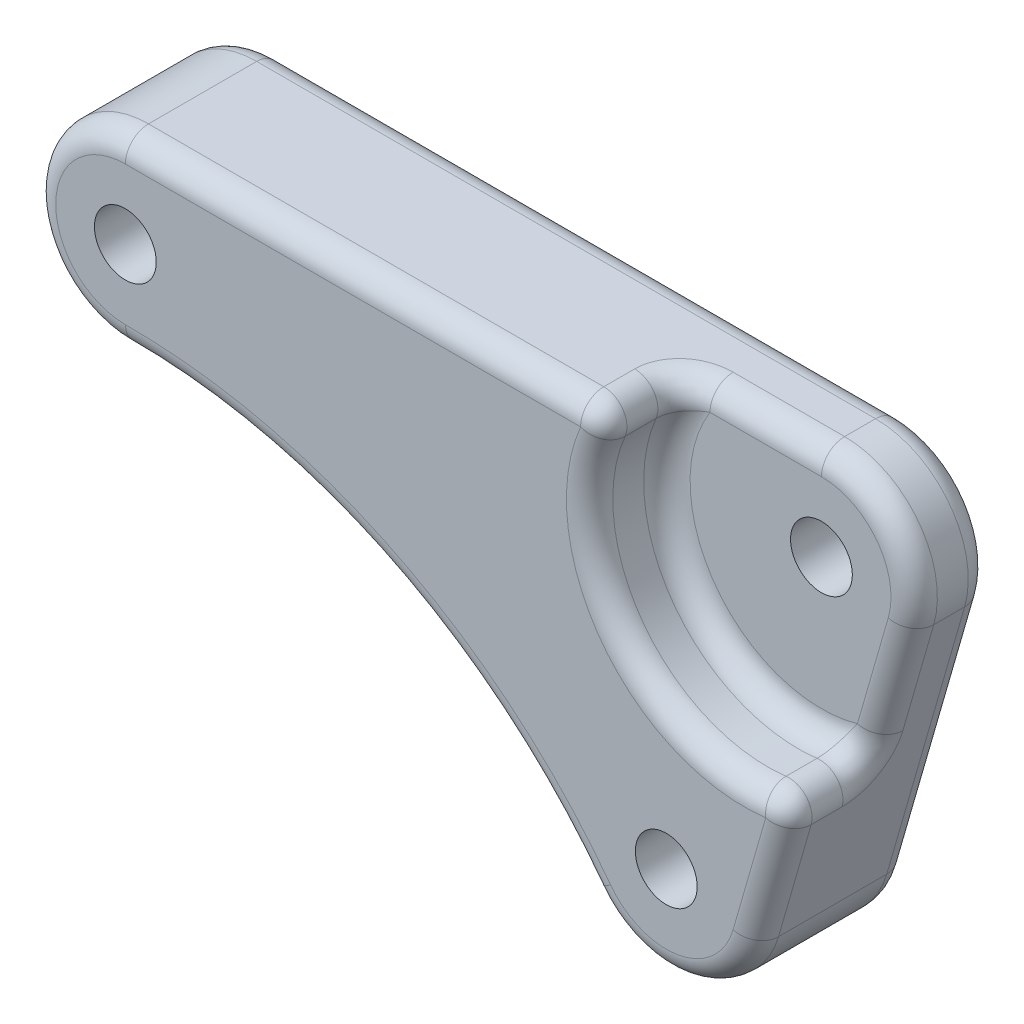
SolidWorks part; units mm, degrees
ref_plane "Ön Düzlem" through (0, 0, 0) normal (0, 0, 1) x (1, 0, 0)
ref_plane "Üst Düzlem" through (0, 0, 0) normal (0, 1, 0) x (1, 0, 0)
ref_plane "Sağ Düzlem" through (0, 0, 0) normal (1, 0, 0) x (0, 0, -1)
sketch "Çizim1" plane through (0, 0, 0) normal (0, 0, 1) x (1, 0, 0)
  line L0 (0, 12) -> (80.082, 12)
  line L1 (81.5311, -38.3216) -> (91.6131, -3.3216)
  arc A0 (0, 12) -> (0.0345, -12) centre (0, 0) ccw
  arc A1 (60.3793, -42.1724) -> (81.5311, -38.3216) centre (70, -35) ccw
  arc A2 (0.0345, -12) -> (60.3793, -42.1724) centre (0.2502, -86.9996) cw
  arc A3 (91.6131, -3.3216) -> (80.082, 12) centre (80.082, 0) ccw
  circle A4 centre (0, 0) radius 4
  circle A5 centre (70, -35) radius 4
  circle A6 centre (80.082, 0) radius 4
  dimension "D1" = 70
  dimension "D3" = 24
  dimension "D4" = 24
  dimension "D5" = 75
  dimension "D6" = 24
  dimension "D2" = 35
extrude "Yükseklik-Ekstrüzyon1" add sketch "Çizim1" along normal blind 20
sketch "Çizim2" plane through (0, 0, 20) normal (0, 0, 1) x (1, 0, 0)
  circle A0 centre (80.082, 0) radius 20
extrude "Kes-Ekstrüzyon1" cut sketch "Çizim2" against normal blind 10
fillet "Radyus1" radius 3 11 edges at (32.041, 12, 20) (84.3577, -28.509, 20) (72.1493, -46.806, 20) (33.7912, -19.9176, 20) (89.67, 7.216, 0) (86.5721, -20.8216, 0) (72.1493, -46.806, 0) (33.7912, -19.9176, 0) (-12, -0.0173, 0) (-12, -0.0173, 20) (40.041, 12, 0)
fillet "Radyus2" radius 3 9 edges at (89.67, 7.216, 10) (72.082, 12, 10) (89.3987, -11.009, 10) (64.082, 12, 13.5) (63.7384, 11.5277, 18.6158) (87.1843, -18.6965, 13.5) (86.1117, -19.0694, 19.169) (64.102, -12.0266, 10) (64.102, -12.0266, 20)
